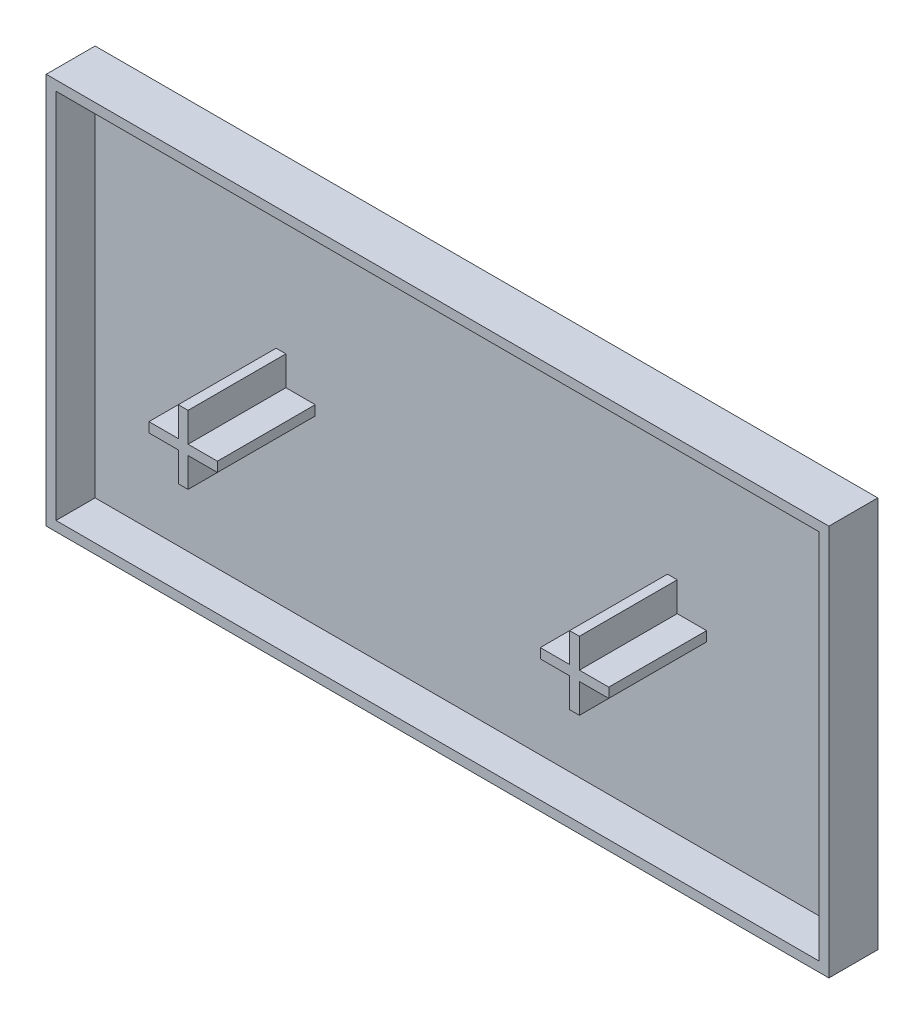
SolidWorks part; units mm, degrees
ref_plane "前视基准面" through (0, 0, 0) normal (0, 0, 1) x (1, 0, 0)
ref_plane "上视基准面" through (0, 0, 0) normal (0, 1, 0) x (1, 0, 0)
ref_plane "右视基准面" through (0, 0, 0) normal (1, 0, 0) x (0, 0, -1)
sketch "草图1" plane through (0, 0, 0) normal (0, 0, 1) x (1, 0, 0)
  line L1 (-40, 20) -> (40, 20)
  line L2 (-40, 20) -> (-40, -20)
  line L3 (-40, -20) -> (40, -20)
  line L4 (40, 20) -> (40, -20)
  dimension "D1" = 80
  dimension "D2" = 40
  dimension "D3" = 20
extrude "凸台-拉伸1" add sketch "草图1" along normal mid plane 5
shell "抽壳2" thickness 1
sketch "草图2" plane through (0, 0, -1.5) normal (0, 0, 1) x (1, 0, 0)
  line L0 (-19.5, 0.5) -> (-16.5, 0.5)
  line L1 (-23.5, 0.5) -> (-20.5, 0.5)
  line L2 (-23.5, 0.5) -> (-23.5, -0.5)
  line L3 (-23.5, -0.5) -> (-20.5, -0.5)
  line L4 (-16.5, 0.5) -> (-16.5, -0.5)
  line L5 (-20.5, 3.5) -> (-19.5, 3.5)
  line L6 (-20.5, 3.5) -> (-20.5, 0.5)
  line L7 (-20.5, -3.5) -> (-19.5, -3.5)
  line L8 (-19.5, 3.5) -> (-19.5, 0.5)
  line L9 (-20.5, -0.5) -> (-20.5, -3.5)
  line L10 (-19.5, -0.5) -> (-19.5, -3.5)
  line L11 (-19.5, -0.5) -> (-16.5, -0.5)
  line L12 (-20, 3.5) -> (-20, -3.5) construction
  line L13 (-20, -3.5) -> (-23.5, 0) construction
  line L14 (-23.5, 0) -> (-16.5, 0) construction
  line L15 (-40, 20) -> (-40, -20) construction
  line L16 (40, 20) -> (-40, 20) construction
  line L17 (0, 20) -> (0, -20) construction
  line L18 (-40, -20) -> (40, -20) construction
  line L19 (23.5, 0) -> (16.5, 0) construction
  line L20 (20, -3.5) -> (23.5, 0) construction
  line L21 (20, 3.5) -> (20, -3.5) construction
  line L22 (19.5, -0.5) -> (16.5, -0.5)
  line L23 (19.5, -0.5) -> (19.5, -3.5)
  line L24 (20.5, -0.5) -> (20.5, -3.5)
  line L25 (19.5, 3.5) -> (19.5, 0.5)
  line L26 (20.5, -3.5) -> (19.5, -3.5)
  line L27 (20.5, 3.5) -> (20.5, 0.5)
  line L28 (20.5, 3.5) -> (19.5, 3.5)
  line L29 (16.5, 0.5) -> (16.5, -0.5)
  line L30 (23.5, -0.5) -> (20.5, -0.5)
  line L31 (23.5, 0.5) -> (23.5, -0.5)
  line L32 (23.5, 0.5) -> (20.5, 0.5)
  line L33 (19.5, 0.5) -> (16.5, 0.5)
  dimension "D1" = 1
  dimension "D2" = 1
  dimension "D3" = 7
  dimension "D4" = 7
  dimension "D5" = 3
  dimension "D6" = 3
  dimension "D7" = 20
  dimension "D8" = 20
extrude "凸台-拉伸2" add sketch "草图2" along normal blind 10
